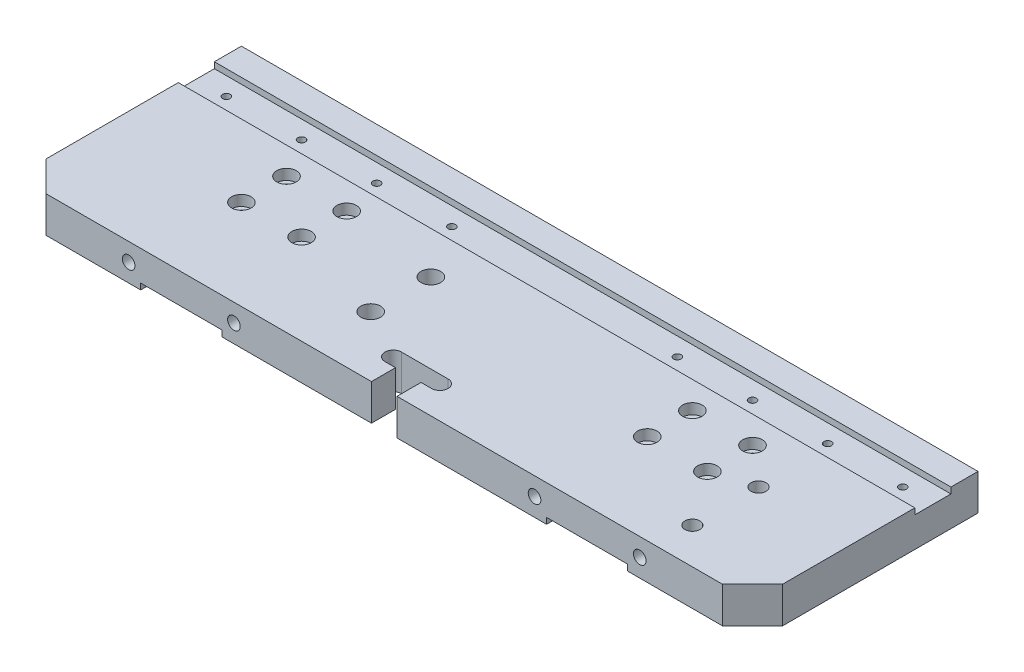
SolidWorks part; units mm, degrees
ref_plane "前视基准面" through (0, 0, 0) normal (0, 0, 1) x (1, 0, 0)
ref_plane "上视基准面" through (0, 0, 0) normal (0, 1, 0) x (1, 0, 0)
ref_plane "右视基准面" through (0, 0, 0) normal (1, 0, 0) x (0, 0, -1)
sketch "草图1" plane through (0, 0, 0) normal (0, 0, 1) x (1, 0, 0)
  line L0 (0, 12) -> (245, 12)
  line L1 (0, 0) -> (41.5, 0)
  line L2 (0, 0) -> (0, 12)
  line L3 (245, 0) -> (245, 12)
  line L4 (41.5, 0) -> (41.5, 2)
  line L5 (68.5, 0) -> (68.5, 2)
  line L6 (41.5, 2) -> (68.5, 2)
  line L7 (68.5, 0) -> (176.5, 0)
  line L8 (203.5, 0) -> (245, 0)
  line L9 (176.5, 0) -> (176.5, 2)
  line L10 (176.5, 2) -> (203.5, 2)
  line L11 (203.5, 2) -> (203.5, 0)
extrude "凸台-拉伸1" add sketch "草图1" along normal blind 75
sketch "草图2" plane through (0, 0, 75) normal (0, 0, 1) x (1, 0, 0)
  circle A0 centre (37.5, 6) radius 2.1
  circle A1 centre (72.5, 6) radius 2.1
  circle A2 centre (172.5, 6) radius 2.1
  circle A3 centre (207.5, 6) radius 2.1
extrude "切除-拉伸1" cut sketch "草图2" against normal blind 15
sketch "草图3" plane through (245, 0, 0) normal (1, 0, 0) x (0, 0, -1)
  line L0 (-21, 10) -> (-21, 12)
  line L1 (-9, 10) -> (-9, 12)
  line L2 (-21, 10) -> (-9, 10)
extrude "切除-拉伸2" cut sketch "草图3" against normal through all and the other way through all
sketch "草图4" plane through (245, 0, 0) normal (1, 0, 0) x (0, 0, -1)
  circle A0 centre (-52, 6) radius 2.5
  circle A1 centre (-38, 6) radius 2.5
sketch "草图5" plane through (0, 0, 0) normal (-1, 0, 0) x (0, 0, 1)
  circle A0 centre (38, 6) radius 2.5
  circle A1 centre (52, 6) radius 2.5
extrude "切除-拉伸3" cut sketch "草图5" against normal blind 15
sketch "草图6" plane through (0, 12, 0) normal (0, 1, 0) x (1, 0, 0)
  line L0 (0, -65) -> (0, 0)
  line L1 (245, -65) -> (245, 0)
  line L2 (0, 0) -> (245, 0)
  line L3 (10, -75) -> (118.25, -75)
  line L4 (10, -75) -> (0, -65)
  line L5 (235, -75) -> (245, -65)
  line L6 (114.75, -67) -> (118.25, -67)
  line L7 (114.75, -61.5) -> (130.25, -61.5)
  line L8 (118.25, -67) -> (118.25, -75)
  line L9 (126.75, -67) -> (126.75, -75)
  line L10 (126.75, -67) -> (130.25, -67)
  line L11 (126.75, -75) -> (235, -75)
  circle A0 centre (10, -15) radius 1.25
  circle A1 centre (35, -15) radius 1.25
  circle A2 centre (60, -15) radius 1.25
  circle A3 centre (85, -15) radius 1.25
  circle A4 centre (160, -15) radius 1.25
  circle A5 centre (185, -15) radius 1.25
  circle A6 centre (210, -15) radius 1.25
  circle A7 centre (235, -15) radius 1.25
  circle A8 centre (213, -41) radius 2.5
  circle A9 centre (213, -63) radius 2.5
  circle A10 centre (45, -30) radius 1.75
  circle A11 centre (65, -30) radius 1.75
  circle A12 centre (65, -45) radius 1.75
  circle A13 centre (45, -45) radius 1.75
  circle A14 centre (180, -30) radius 1.75
  circle A15 centre (200, -30) radius 1.75
  circle A16 centre (200, -45) radius 1.75
  circle A17 centre (180, -45) radius 1.75
  circle A18 centre (98, -55) radius 3.25
  circle A19 centre (98, -35) radius 3.25
  arc A20 (130.25, -67) -> (130.25, -61.5) centre (130.25, -64.25) ccw
  arc A21 (114.75, -61.5) -> (114.75, -67) centre (114.75, -64.25) ccw
extrude "切除-拉伸4" cut sketch "草图6" against normal blind 15 flip side to cut
sketch "草图7" plane through (0, 12, 0) normal (0, 1, 0) x (1, 0, 0)
  circle A0 centre (45, -30) radius 3.25
  circle A1 centre (65, -30) radius 3.25
  circle A2 centre (65, -45) radius 3.25
  circle A3 centre (45, -45) radius 3.25
  circle A4 centre (180, -30) radius 3.25
  circle A5 centre (200, -30) radius 3.25
  circle A6 centre (200, -45) radius 3.25
  circle A7 centre (180, -45) radius 3.25
extrude "切除-拉伸5" cut sketch "草图7" against normal blind 3.5
sketch "草图8" plane through (0, 12, 0) normal (0, 1, 0) x (1, 0, 0)
  circle A0 centre (98, -55) radius 5.5 construction
  circle A1 centre (98, -35) radius 5.5 construction
sketch "草图9" plane through (0, 0, 0) normal (0, -1, 0) x (1, 0, 0)
  circle A0 centre (98, 55) radius 5.5
  circle A1 centre (98, 35) radius 5.5
extrude "切除-拉伸6" cut sketch "草图9" against normal blind 3.5
